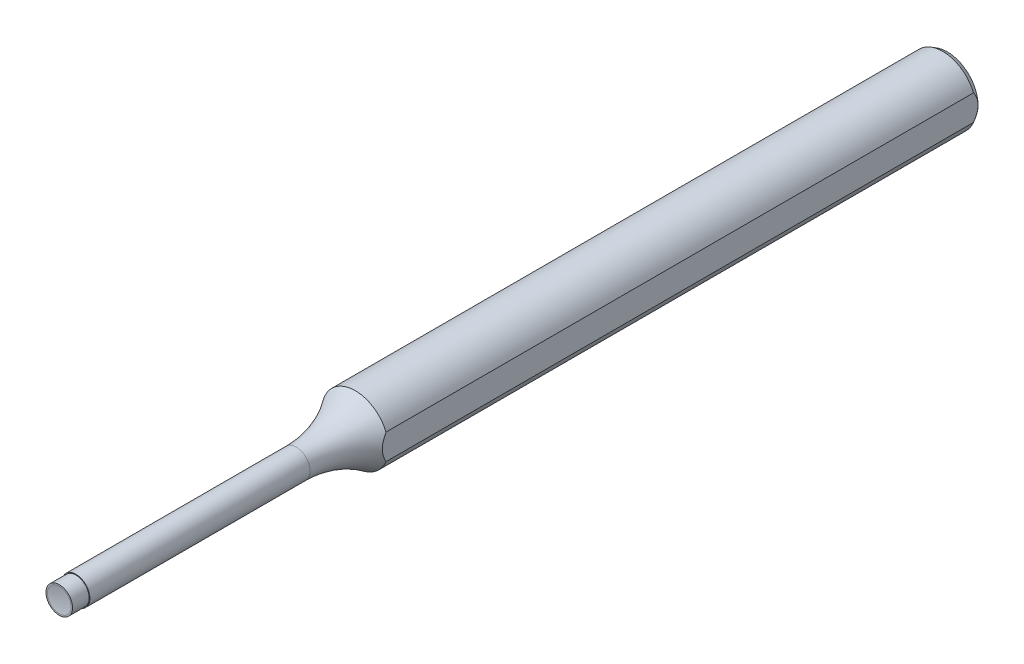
SolidWorks part; units mm, degrees
ref_plane "Front Plane" through (0, 0, 0) normal (0, 0, 1) x (1, 0, 0)
ref_plane "Top Plane" through (0, 0, 0) normal (0, 1, 0) x (1, 0, 0)
ref_plane "Right Plane" through (0, 0, 0) normal (1, 0, 0) x (0, 0, -1)
sketch "Sketch1" plane through (0, 0, 0) normal (0, 0, 1) x (1, 0, 0)
  circle A0 centre (0, 0) radius 4.765
  dimension "D1" = 9.53
extrude "Boss-Extrude1" add sketch "Sketch1" against normal blind 127
sketch "Sketch2" plane through (0, 0, 0) normal (0, 0, 1) x (1, 0, 0)
  circle A0 centre (0, 0) radius 2
  dimension "D1" = 4
extrude "Cut-Extrude1" cut sketch "Sketch2" against normal blind 42.3333 flip side to cut
sketch "Sketch3" plane through (0, 0, 0) normal (0, 0, 1) x (1, 0, 0)
  circle A0 centre (0, 0) radius 1.9
  dimension "D1" = 3.8
extrude "Cut-Extrude2" cut sketch "Sketch3" against normal blind 2.3825 flip side to cut
sketch "Sketch4" plane through (0, 0, 0) normal (1, 0, 0) x (0, 0, -1)
  line L0 (0, 0) -> (0, 1.7)
  line L1 (0, 1.9) -> (0, -1.9) construction
  line L2 (0.1529, 0) -> (0.1529, 1.7) construction
  line L3 (0, 0) -> (0.1529, 0)
  line L4 (0, 0) -> (0, -1.7) construction
  arc A0 (0.1529, 0) -> (0, 1.7) centre (-9.3771, 0) ccw
  dimension "D2" = 9.53
  dimension "D1" = 3.4
revolve "Cut-Revolve1" cut sketch "Sketch4" angle 360 about L3
chamfer "Chamfer1" distance 0.6353 angle 30 1 edges at (4.765, 0, -127)
sketch "Sketch5" plane through (0, 0, 0) normal (1, 0, 0) x (0, 0, -1)
  line L0 (42.3333, 0) -> (33.8831, 0)
  line L1 (42.3333, 4.765) -> (42.3333, -4.765) construction
  line L2 (33.8831, 0) -> (33.8831, 2)
  line L3 (42.3333, 2) -> (2.3825, 2) construction
  line L4 (42.3333, 4.765) -> (42.3333, 0)
  line L5 (33.8831, 2) -> (42.3333, 2) construction
  arc A0 (33.8831, 2) -> (42.3333, 4.765) centre (33.8831, 16.295) ccw
  dimension "D1" = 14.295
revolve "Revolve1" add sketch "Sketch5" angle 360 about L0
sketch "Sketch6" plane through (0, 0, 0) normal (1, 0, 0) x (0, 0, -1)
  line L0 (84.6667, 0) -> (98.9617, 0)
  line L1 (84.6667, 0) -> (84.6667, 9.53)
  line L2 (84.6667, 9.53) -> (90.7084, 9.53)
  line L3 (98.9617, 0) -> (98.9617, 4.765)
  line L4 (126.3647, 4.765) -> (42.3333, 4.765) construction
  line L5 (98.9617, 4.765) -> (84.6667, 4.765) construction
  line L6 (127, -4.765) -> (127, 4.765) construction
  arc A0 (98.9617, 4.765) -> (90.7084, 9.53) centre (98.9617, 14.295) cw
  dimension "D2" = 9.53
  dimension "D1" = 42.3333
  dimension "D3" = 14.295
revolve "Revolve2" [suppressed] add sketch "Sketch6" angle 360 about L0
sketch "Sketch7" plane through (0, 0, -127) normal (0, 0, -1) x (-1, 0, 0)
  line L9 (-8.0649, 1.8333) -> (-4.3982, 1.8333)
  line L10 (-8.0649, 1.8333) -> (-8.0649, -1.8333)
  line L11 (-8.0649, -1.8333) -> (-4.3982, -1.8333)
  line L12 (-4.3982, 1.8333) -> (-4.3982, -1.8333)
  circle A5 centre (0, 0) radius 4.765 construction
  circle A6 centre (0, 0) radius 4.3982 construction
  point P8 (-4.3982, 0)
extrude "Cut-Extrude3" cut sketch "Sketch7" against normal through all
